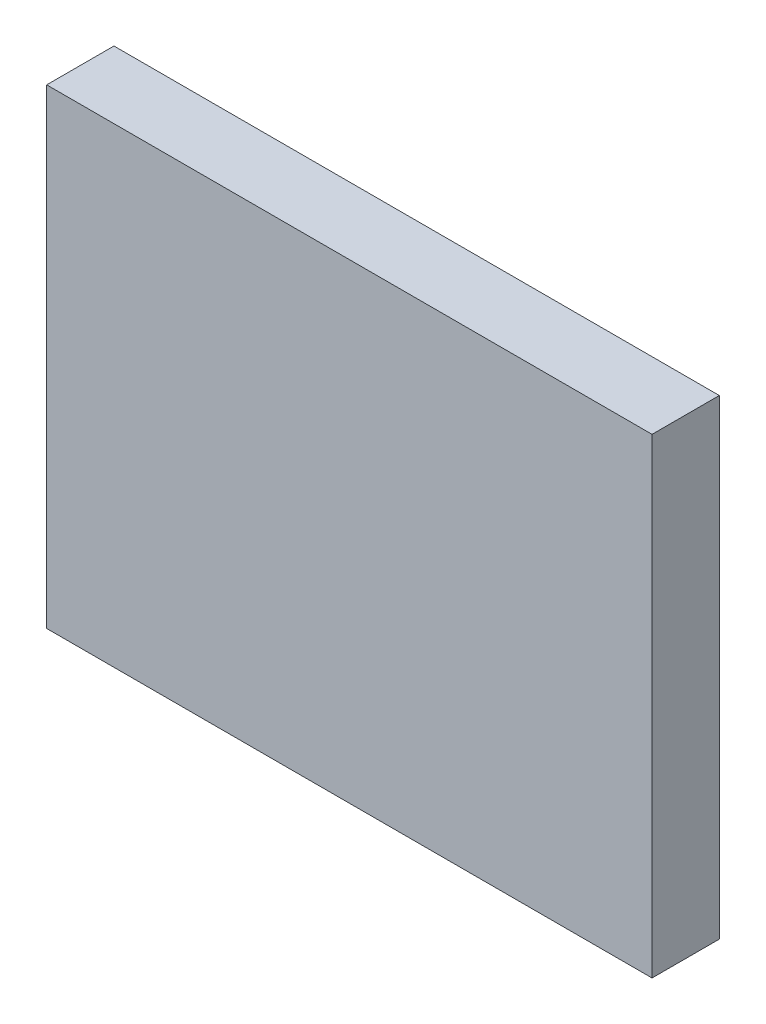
SolidWorks part; units mm, degrees
ref_plane "Front" through (0, 0, 0) normal (0, 0, 1) x (1, 0, 0)
ref_plane "Top" through (0, 0, 0) normal (0, 1, 0) x (1, 0, 0)
ref_plane "Right" through (0, 0, 0) normal (1, 0, 0) x (0, 0, -1)
sketch "Sketch1"
  dimension "D1" = 254
  dimension "D2" = 203.2
extrude "Extrude1" add sketch "Sketch1" against normal blind 25.4
sketch "Sketch3"
  dimension "D1" = 12.7
  dimension "D2" = 12.7
extrude "Extrude3" cut sketch "Sketch3" against normal through all
sketch "Sketch2"
  dimension "D1" = 25.4
  dimension "D2" = 25.4
  dimension "D3" = 50.8
  dimension "D4" = 50.8
